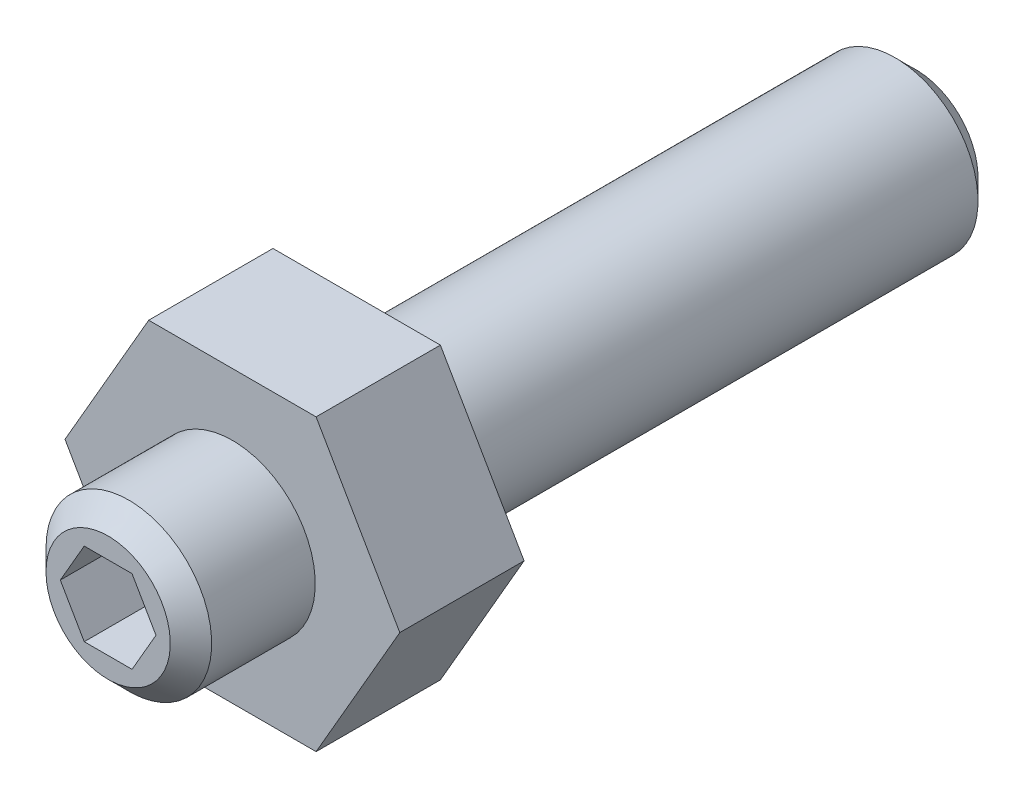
SolidWorks part; units mm, degrees
ref_plane "Plan de face" through (0, 0, 0) normal (0, 0, 1) x (1, 0, 0)
ref_plane "Plan de dessus" through (0, 0, 0) normal (0, 1, 0) x (1, 0, 0)
ref_plane "Plan de droite" through (0, 0, 0) normal (1, 0, 0) x (0, 0, -1)
sketch "Esquisse1" plane through (0, 0, 0) normal (0, 0, 1) x (1, 0, 0)
  line L1 (4.0415, 0) -> (2.0207, 3.5)
  line L2 (2.0207, 3.5) -> (-2.0207, 3.5)
  line L3 (-2.0207, 3.5) -> (-4.0415, 0)
  line L4 (-4.0415, 0) -> (-2.0207, -3.5)
  line L5 (-2.0207, -3.5) -> (2.0207, -3.5)
  line L6 (2.0207, -3.5) -> (4.0415, 0)
  circle A0 centre (0, 0) radius 3.5 construction
  dimension "D1" = 7
extrude "Extrusion1" add sketch "Esquisse1" along normal blind 3
sketch "Esquisse2" plane through (0, 0, 0) normal (0, 0, -1) x (-1, 0, 0)
  circle A0 centre (0, 0) radius 2
  dimension "D1" = 4
extrude "Extrusion2" add sketch "Esquisse2" along normal blind 13.5 and the other way blind 6
chamfer "Chanfrein1" distance 0.5 angle 45 2 edges at (-2, 0, -13.5) (-2, 0, 6)
sketch "Esquisse3" plane through (0, 0, 6) normal (0, 0, 1) x (1, 0, 0)
  line L1 (1.1547, 0) -> (0.5774, 1)
  line L2 (0.5774, 1) -> (-0.5774, 1)
  line L3 (-0.5774, 1) -> (-1.1547, 0)
  line L4 (-1.1547, 0) -> (-0.5774, -1)
  line L5 (-0.5774, -1) -> (0.5774, -1)
  line L6 (0.5774, -1) -> (1.1547, 0)
  circle A0 centre (0, 0) radius 1 construction
  dimension "D1" = 2
extrude "Enlèv. mat.-Extru.1" cut sketch "Esquisse3" against normal blind 4
